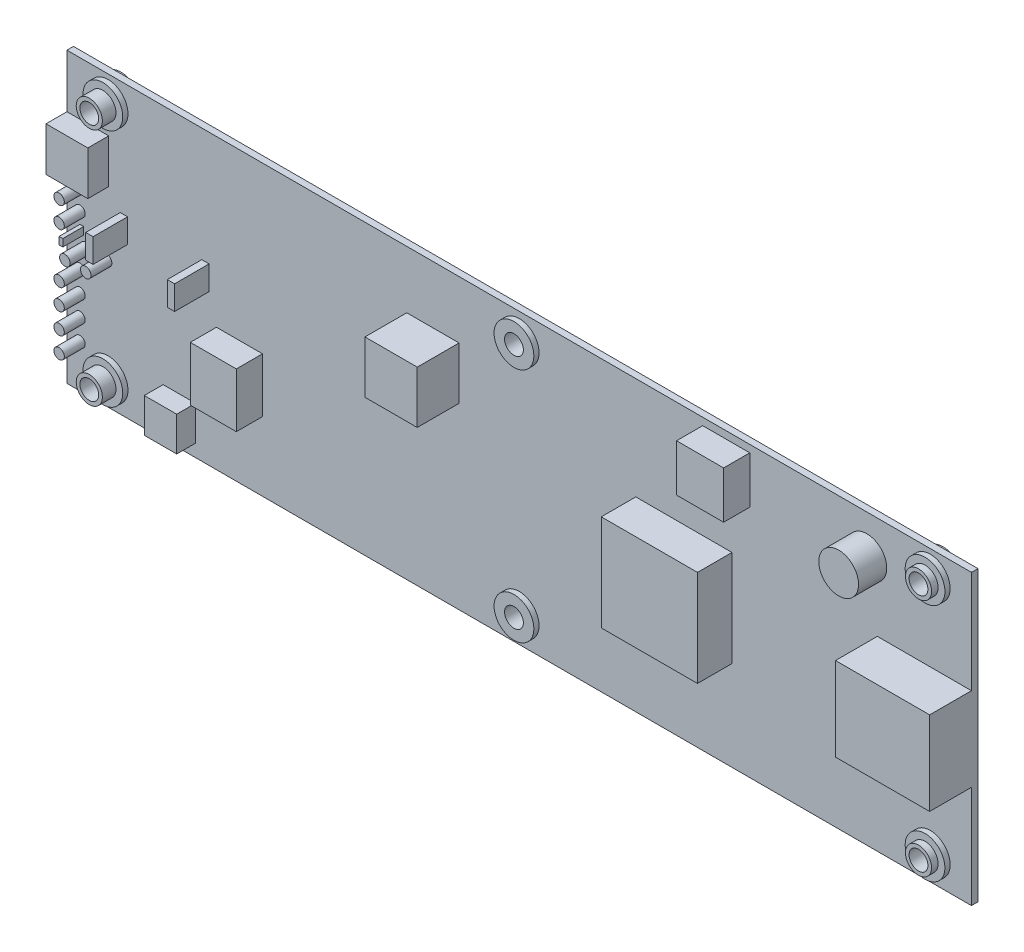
SolidWorks part; units mm, degrees
ref_plane "Front Plane" through (0, 0, 0) normal (0, 0, 1) x (1, 0, 0)
ref_plane "Top Plane" through (0, 0, 0) normal (0, 1, 0) x (1, 0, 0)
ref_plane "Right Plane" through (0, 0, 0) normal (1, 0, 0) x (0, 0, -1)
sketch "Sketch1" plane through (0, 0, 0) normal (0, 0, 1) x (1, 0, 0)
  line L1 (0, 0) -> (219.71, 0)
  line L2 (0, 0) -> (0, 70.104)
  line L3 (0, 70.104) -> (219.71, 70.104)
  line L4 (219.71, 0) -> (219.71, 70.104)
  dimension "D1" = 70.104
  dimension "D2" = 219.71
extrude "pc_board" add sketch "Sketch1" along normal blind 1.5875
sketch "Sketch2" plane through (0, 0, 1.5875) normal (0, 0, 1) x (1, 0, 0)
  line L0 (219.71, 0) -> (219.71, 70.104) construction
  line L2 (219.71, 0) -> (219.71, 70.104) construction
  line L5 (219.71, 70.104) -> (0, 70.104) construction
  line L6 (109.855, 70.104) -> (109.855, 0) construction
  line L7 (0, 0) -> (219.71, 0) construction
  line L8 (219.71, 35.052) -> (0, 35.052) construction
  line L9 (0, 70.104) -> (0, 0) construction
  circle A0 centre (209.7024, 64.1096) radius 2.286
  circle A1 centre (10.0076, 64.1096) radius 2.286
  circle A2 centre (109.855, 63.754) radius 2.286
  circle A3 centre (209.7024, 5.9944) radius 2.286
  circle A4 centre (109.855, 6.35) radius 2.286
  circle A5 centre (10.0076, 5.9944) radius 2.286
  dimension "D1" = 4.572
  dimension "D2" = 10.0076
  dimension "D3" = 5.9944
  dimension "D4" = 4.572
  dimension "D5" = 58.1152
  dimension "D6" = 109.855
extrude "thru_holes" cut sketch "Sketch2" against normal through all
sketch "Sketch4" plane through (0, 0, 1.5875) normal (0, 0, 1) x (1, 0, 0)
  line L0 (0, 70.104) -> (0, 0) construction
  line L1 (95.25, 43.434) -> (82.55, 43.434)
  line L2 (95.25, 43.434) -> (95.25, 56.134)
  line L3 (95.25, 56.134) -> (82.55, 56.134)
  line L4 (82.55, 43.434) -> (82.55, 56.134)
  line L5 (219.71, 70.104) -> (0, 70.104) construction
  dimension "D1" = 12.7
  dimension "D2" = 12.7
  dimension "D3" = 95.25
  dimension "D4" = 26.67
extrude "transformer" add sketch "Sketch4" along normal blind 10.16
sketch "Sketch5" plane through (0, 0, 1.5875) normal (0, 0, 1) x (1, 0, 0)
  line L0 (219.71, 0) -> (219.71, 70.104) construction
  line L1 (219.71, 45.212) -> (196.85, 45.212)
  line L2 (219.71, 45.212) -> (219.71, 24.892)
  line L3 (219.71, 24.892) -> (196.85, 24.892)
  line L4 (196.85, 45.212) -> (196.85, 24.892)
  line L5 (219.71, 70.104) -> (0, 70.104) construction
  dimension "D1" = 22.86
  dimension "D2" = 20.32
  dimension "D3" = 45.212
extrude "connector" add sketch "Sketch5" along normal blind 10.16
sketch "Sketch6" plane through (0, 0, 1.5875) normal (0, 0, 1) x (1, 0, 0)
  line L0 (219.71, 70.104) -> (0, 70.104) construction
  line L1 (138.176, 45.212) -> (161.544, 45.212)
  line L2 (138.176, 45.212) -> (138.176, 21.844)
  line L3 (138.176, 21.844) -> (161.544, 21.844)
  line L4 (161.544, 45.212) -> (161.544, 21.844)
  line L5 (219.71, 45.212) -> (219.71, 70.104) construction
  dimension "D1" = 23.368
  dimension "D2" = 23.368
  dimension "D3" = 48.26
  dimension "D4" = 81.534
extrude "cpu" add sketch "Sketch6" along normal blind 8.382
sketch "Sketch7" plane through (0, 0, 1.5875) normal (0, 0, 1) x (1, 0, 0)
  line L0 (219.71, 70.104) -> (0, 70.104) construction
  line L1 (154.432, 68.326) -> (165.862, 68.326)
  line L2 (154.432, 68.326) -> (154.432, 56.896)
  line L3 (154.432, 56.896) -> (165.862, 56.896)
  line L4 (165.862, 68.326) -> (165.862, 56.896)
  line L5 (219.71, 45.212) -> (219.71, 70.104) construction
  dimension "D1" = 11.43
  dimension "D2" = 11.43
  dimension "D3" = 1.778
  dimension "D4" = 65.278
extrude "inductor" add sketch "Sketch7" along normal blind 6.35
sketch "Sketch8" plane through (0, 0, 1.5875) normal (0, 0, 1) x (1, 0, 0)
  line L0 (0, 0) -> (219.71, 0) construction
  line L1 (23.368, 3.048) -> (31.242, 3.048)
  line L2 (23.368, 3.048) -> (23.368, 11.43)
  line L3 (23.368, 11.43) -> (31.242, 11.43)
  line L4 (31.242, 3.048) -> (31.242, 11.43)
  line L5 (0, 70.104) -> (0, 0) construction
  dimension "D1" = 8.382
  dimension "D2" = 7.874
  dimension "D3" = 3.048
  dimension "D4" = 31.242
extrude "Vishay" add sketch "Sketch8" along normal blind 4.572
sketch "Sketch9" plane through (0, 0, 1.5875) normal (0, 0, 1) x (1, 0, 0)
  line L0 (0, 70.104) -> (0, 0) construction
  line L1 (12.954, 42.418) -> (14.732, 42.418)
  line L2 (12.954, 42.418) -> (12.954, 36.576)
  line L3 (12.954, 36.576) -> (14.732, 36.576)
  line L4 (14.732, 42.418) -> (14.732, 36.576)
  line L5 (32.766, 42.418) -> (34.544, 42.418)
  line L6 (32.766, 42.418) -> (32.766, 36.576)
  line L7 (32.766, 36.576) -> (34.544, 36.576)
  line L8 (34.544, 42.418) -> (34.544, 36.576)
  line L9 (219.71, 70.104) -> (0, 70.104) construction
  dimension "D1" = 5.842
  dimension "D2" = 5.842
  dimension "D3" = 1.778
  dimension "D4" = 1.778
  dimension "D5" = 14.732
  dimension "D6" = 34.544
  dimension "D7" = 33.528
  dimension "D8" = 33.528
extrude "caps" add sketch "Sketch9" along normal blind 8.382
sketch "Sketch10" plane through (0, 0, 1.5875) normal (0, 0, 1) x (1, 0, 0)
  line L0 (0, 0) -> (219.71, 0) construction
  line L1 (36.322, 29.972) -> (47.498, 29.972)
  line L2 (36.322, 29.972) -> (36.322, 16.764)
  line L3 (36.322, 16.764) -> (47.498, 16.764)
  line L4 (47.498, 29.972) -> (47.498, 16.764)
  line L5 (0, 70.104) -> (0, 0) construction
  dimension "D1" = 13.208
  dimension "D2" = 11.176
  dimension "D3" = 29.972
  dimension "D4" = 47.498
extrude "crystal" add sketch "Sketch10" along normal blind 6.35
sketch "Sketch11" plane through (0, 0, 1.5875) normal (0, 0, 1) x (1, 0, 0)
  line L1 (219.71, 45.212) -> (219.71, 70.104) construction
  line L2 (219.71, 70.104) -> (0, 70.104) construction
  circle A0 centre (194.31, 60.706) radius 4.826
  dimension "D1" = 9.652
  dimension "D2" = 25.4
  dimension "D3" = 9.398
extrude "Extrude9" add sketch "Sketch11" along normal blind 6.858
sketch "Sketch13" plane through (0, 0, 1.5875) normal (0, 0, 1) x (1, 0, 0)
  line L0 (3.175, 70.104) -> (3.175, 0) construction
  line L1 (219.71, 70.104) -> (0, 70.104) construction
  line L2 (0, 0) -> (219.71, 0) construction
  line L4 (3.175, 35.052) -> (4.0867, 35.052)
  line L5 (3.175, 35.052) -> (3.175, 33.2628)
  line L6 (0, 70.104) -> (0, 0) construction
  line L7 (3.175, 33.2628) -> (4.0867, 33.2628)
  line L8 (4.0867, 35.052) -> (4.0867, 33.2628)
  circle A0 centre (3.175, 42.926) radius 1.27
  circle A1 centre (3.175, 37.846) radius 1.27
  circle A2 centre (3.175, 25.654) radius 1.27
  circle A3 centre (3.175, 20.574) radius 1.27
  circle A4 centre (3.175, 15.494) radius 1.27
  circle A5 centre (3.175, 10.414) radius 1.27
  circle A6 centre (4.572, 30.734) radius 1.27
  circle A7 centre (9.652, 30.734) radius 1.27
other "AlignGroup1" parameters "D2"=1.8714, "D9"=2.0667, "D10"=2.54, "D11"=2.54, "D12"=2.54, "D1"=70.104, "D3"=27.178, "D4"=32.258, "D5"=44.45, "D6"=49.53, "D7"=54.61, "D8"=59.69
extrude "solder_pins" add sketch "Sketch13" along normal blind 5.08
sketch "Sketch14" plane through (0, 0, 1.5875) normal (0, 0, 1) x (1, 0, 0)
  line L1 (0, 57.15) -> (10.16, 57.15)
  line L2 (0, 57.15) -> (0, 46.482)
  line L3 (0, 46.482) -> (10.16, 46.482)
  line L4 (10.16, 57.15) -> (10.16, 46.482)
  line L5 (219.71, 70.104) -> (0, 70.104) construction
  dimension "D1" = 10.16
  dimension "D2" = 10.668
  dimension "D3" = 23.622
extrude "vishay2" add sketch "Sketch14" along normal blind 5.08
sketch "Sketch15" plane through (0, 0, 1.5875) normal (0, 0, 1) x (1, 0, 0)
  line L1 (109.855, 70.104) -> (109.855, 0) construction
  line L2 (219.71, 70.104) -> (0, 70.104) construction
  line L3 (0, 0) -> (219.71, 0) construction
  line L4 (219.71, 35.052) -> (0, 35.052) construction
  line L5 (219.71, 24.892) -> (219.71, 45.212) construction
  line L6 (0, 46.482) -> (0, 0) construction
  circle A0 centre (209.7024, 64.1096) radius 4.826
  circle A9 centre (209.7024, 64.1096) radius 2.286
  circle A10 centre (10.0076, 64.1096) radius 2.286
  circle A11 centre (10.0076, 64.1096) radius 4.826
  circle A12 centre (109.855, 63.754) radius 2.286
  circle A13 centre (109.855, 63.754) radius 4.826
  circle A14 centre (109.855, 6.35) radius 4.826
  circle A15 centre (109.855, 6.35) radius 2.286
  circle A16 centre (10.0076, 5.9944) radius 4.826
  circle A17 centre (10.0076, 5.9944) radius 2.286
  circle A18 centre (209.7024, 5.9944) radius 2.286
  circle A19 centre (209.7024, 5.9944) radius 4.826
  dimension "D1" = 9.652
  dimension "D2" = 4.572
  dimension "D3" = 4.572
  dimension "D4" = 9.652
extrude "grommets" add sketch "Sketch15" along normal blind 1.27
sketch "Sketch16" plane through (0, 0, 2.8575) normal (0, 0, 1) x (1, 0, 0)
  circle A0 centre (10.0076, 64.1096) radius 3.175
  circle A1 centre (10.0076, 5.9944) radius 3.175
  circle A2 centre (10.0076, 64.1096) radius 2.286
  circle A4 centre (10.0076, 5.9944) radius 2.286
  dimension "D1" = 6.35
  dimension "D2" = 6.35
extrude "rear_spacers" add sketch "Sketch16" along normal blind 3.302
sketch "Sketch17" plane through (0, 0, 0) normal (-1, 0, 0) x (0, 0, 1)
  arc A0 (6.1595, 67.2846) -> (6.1595, 2.8194) centre (-60.0738, 35.052) cw
  dimension "D1" = 73.66
sketch "Sketch18" plane through (0, 0, 2.8575) normal (0, 0, 1) x (1, 0, 0)
  circle A0 centre (209.7024, 5.9944) radius 3.175
  circle A1 centre (209.7024, 64.1096) radius 3.175
  circle A2 centre (209.7024, 64.1096) radius 2.286
  circle A3 centre (209.7024, 5.9944) radius 2.286
  dimension "D1" = 6.35
  dimension "D2" = 6.35
extrude "front_spacers" add sketch "Sketch18" along normal blind 1.5875
sketch "Sketch19" plane through (0, 0, 0) normal (0, 0, -1) x (-1, 0, 0)
  circle A0 centre (-10.0076, 64.1096) radius 4.826
  circle A1 centre (-10.0076, 5.9944) radius 4.826
  circle A2 centre (-109.855, 6.35) radius 4.826
  circle A3 centre (-109.855, 63.754) radius 4.826
  circle A4 centre (-209.7024, 5.9944) radius 4.826
  circle A5 centre (-209.7024, 64.1096) radius 4.826
  circle A6 centre (-209.7024, 64.1096) radius 2.286
  circle A7 centre (-209.7024, 5.9944) radius 2.286
  circle A8 centre (-109.855, 63.754) radius 2.286
  circle A9 centre (-109.855, 6.35) radius 2.286
  circle A10 centre (-10.0076, 5.9944) radius 2.286
  circle A11 centre (-10.0076, 64.1096) radius 2.286
extrude "back_grommets" add sketch "Sketch19" along normal blind 1.524
